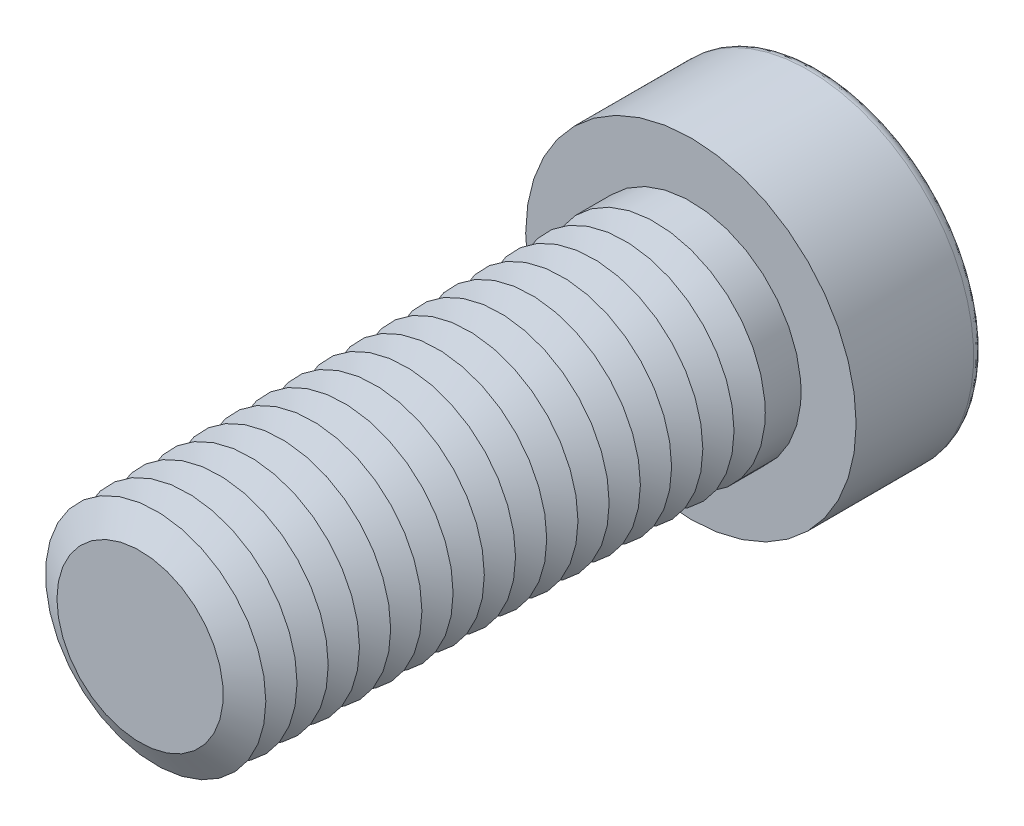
SolidWorks part; units mm, degrees
ref_plane "Front Plane" through (0, 0, 0) normal (0, 0, 1) x (1, 0, 0)
ref_plane "Top Plane" through (0, 0, 0) normal (0, 1, 0) x (1, 0, 0)
ref_plane "Right Plane" through (0, 0, 0) normal (1, 0, 0) x (0, 0, -1)
sketch "Sketch1" plane through (0, 0, 0) normal (0, 0, 1) x (1, 0, 0)
  circle A0 centre (0, 0) radius 6
  dimension "D1" = 12
extrude "Boss-Extrude1" add sketch "Sketch1" along normal blind 30
sketch "Sketch2" plane through (0, 0, 0) normal (0, 0, -1) x (-1, 0, 0)
  circle A0 centre (0, 0) radius 9
  dimension "D1" = 18
extrude "Boss-Extrude2" add sketch "Sketch2" along normal blind 7
sketch "Sketch3" plane through (0, 0, -7) normal (0, 0, -1) x (-1, 0, 0)
  line L1 (-2.3094, 4) -> (-4.6188, 0)
  line L2 (-4.6188, 0) -> (-2.3094, -4)
  line L3 (-2.3094, -4) -> (2.3094, -4)
  line L4 (2.3094, -4) -> (4.6188, 0)
  line L5 (4.6188, 0) -> (2.3094, 4)
  line L6 (2.3094, 4) -> (-2.3094, 4)
  circle A0 centre (0, 0) radius 4 construction
  dimension "D1" = 8
extrude "Cut-Extrude1" cut sketch "Sketch3" against normal blind 6
fillet "Fillet1" radius 0.6 1 edges at (-9, 0, -7)
sketch "Sketch4" plane through (0, 0, -1) normal (0, 0, -1) x (-1, 0, 0)
  line L0 (2.3094, -4) -> (4.6188, 0) construction
  circle A0 centre (0, 0) radius 4
extrude "Cut-Extrude2" cut sketch "Sketch4" against normal through all draft 60
sketch "Sketch5" plane through (0, 0, -7) normal (0, 0, -1) x (-1, 0, 0)
  circle A0 centre (0, 0) radius 4.6188
extrude "Cut-Extrude3" cut sketch "Sketch5" against normal through all draft 75
sketch "Sketch7" plane through (0, 0, 0) normal (1, 0, 0) x (0, 0, -1)
  line L25 (-30, 4.5278) -> (-29.15, 6)
  line L26 (-30, 6) -> (-30, -6) construction
  line L27 (-29.15, 6) -> (-30.85, 6)
  line L28 (-30.85, 6) -> (-30, 4.5278)
  line L29 (0, 6) -> (-30, 6) construction
  dimension "D1" = 1.7
revolve "Cut-Revolve1" cut sketch "Sketch7" angle 360 about axis through (0, 0, 30) along (0, 0, -1)
pattern_linear "LPattern1" count 17 spacing 1.7 along (0, 0, -1) of "Cut-Revolve1"
